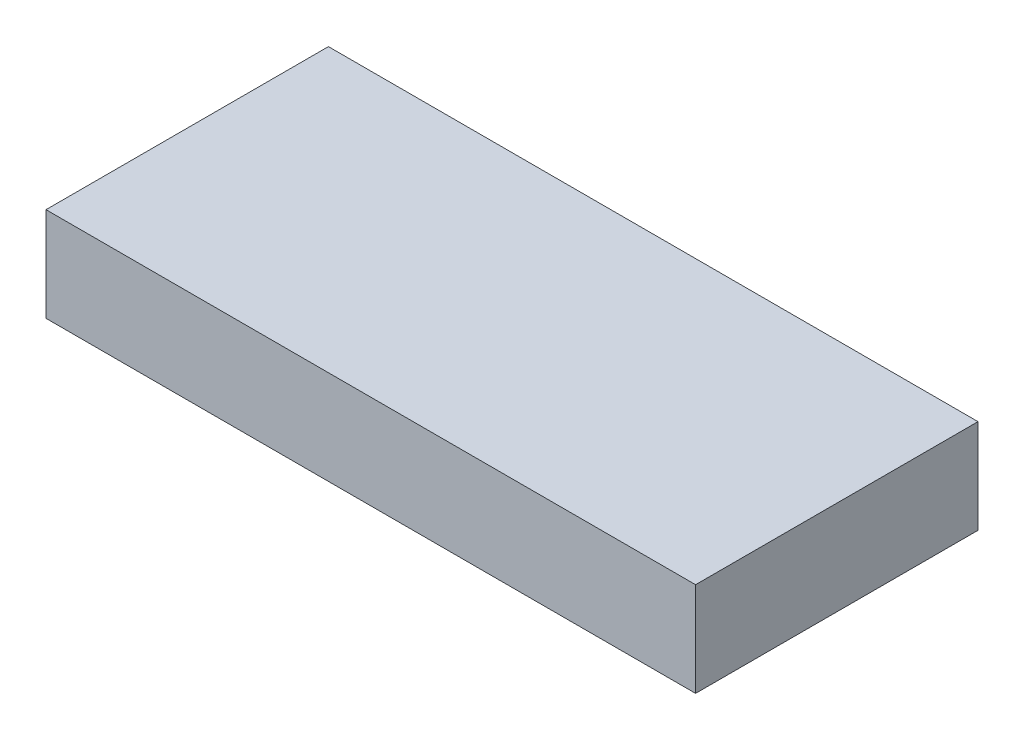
SolidWorks part; units mm, degrees
ref_plane "Front Plane" through (0, 0, 0) normal (0, 0, 1) x (1, 0, 0)
ref_plane "Top Plane" through (0, 0, 0) normal (0, 1, 0) x (1, 0, 0)
ref_plane "Right Plane" through (0, 0, 0) normal (1, 0, 0) x (0, 0, -1)
sketch "Sketch1" plane through (0, 0, 0) normal (1, 0, 0) x (0, 0, -1)
  line L0 (-15, -5) -> (15, 5) construction
  line L1 (-15, 5) -> (15, 5)
  line L2 (-15, 5) -> (-15, -5)
  line L3 (-15, -5) -> (15, -5)
  line L4 (15, 5) -> (15, -5)
  dimension "D1" = 30
  dimension "D2" = 10
extrude "Extrude1" add sketch "Sketch1" along normal blind 69
